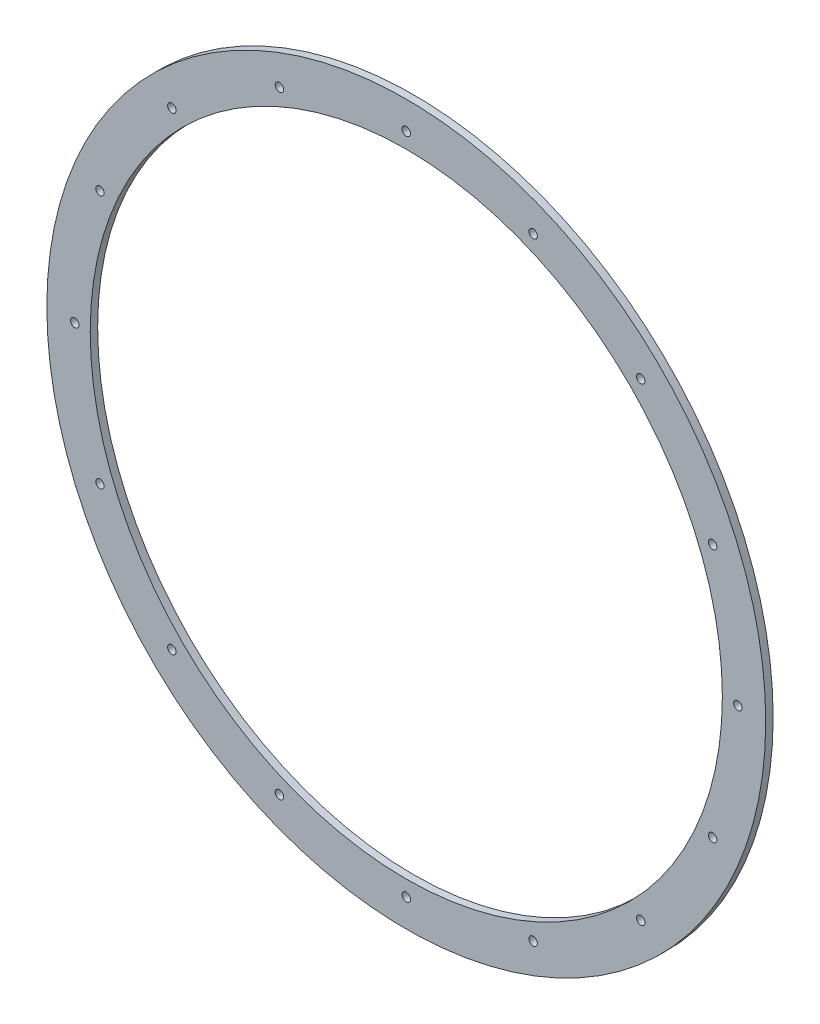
SolidWorks part; units mm, degrees
ref_plane "前视基准面" through (0, 0, 0) normal (0, 0, 1) x (1, 0, 0)
ref_plane "上视基准面" through (0, 0, 0) normal (0, 1, 0) x (1, 0, 0)
ref_plane "右视基准面" through (0, 0, 0) normal (1, 0, 0) x (0, 0, -1)
sketch "草图1" plane through (0, 0, 0) normal (0, 0, 1) x (1, 0, 0)
  circle A0 centre (0, 0) radius 290
  circle A1 centre (0, 0) radius 255
  dimension "D1" = 580
  dimension "D2" = 510
extrude "拉伸1" add sketch "草图1" along normal mid plane 6
hole_wizard "M8 螺纹孔1" positions "草图3" profile "草图2" tap size "M8" standard "GB"
sketch "草图3" plane through (0, 0, -3) normal (0, 0, -1) x (-1, 0, 0)
  point P0 (0, 267.5)
  dimension "D1" = 267.5
sketch "草图2" plane through (0, 267.5, -3) normal (1, 0, 0) x (0, 1, 0)
  line L0 (0, 0) -> (0, 6)
  line L1 (0, 6) -> (3.4, 6)
  line L2 (3.4, 6) -> (3.4, 0)
  line L5 (3.4, 0) -> (0, 0)
  line L11 (0, -6.35) -> (0, 107.95) construction
  dimension "通孔螺纹孔钻头直径" = 6.8
  dimension "通孔螺纹孔钻头深度" = 6
pattern_circular "阵列(圆周)1" count 16 over 360 about axis through (0, 0, 0) along (0, 0, 1) of "M8 螺纹孔1"
